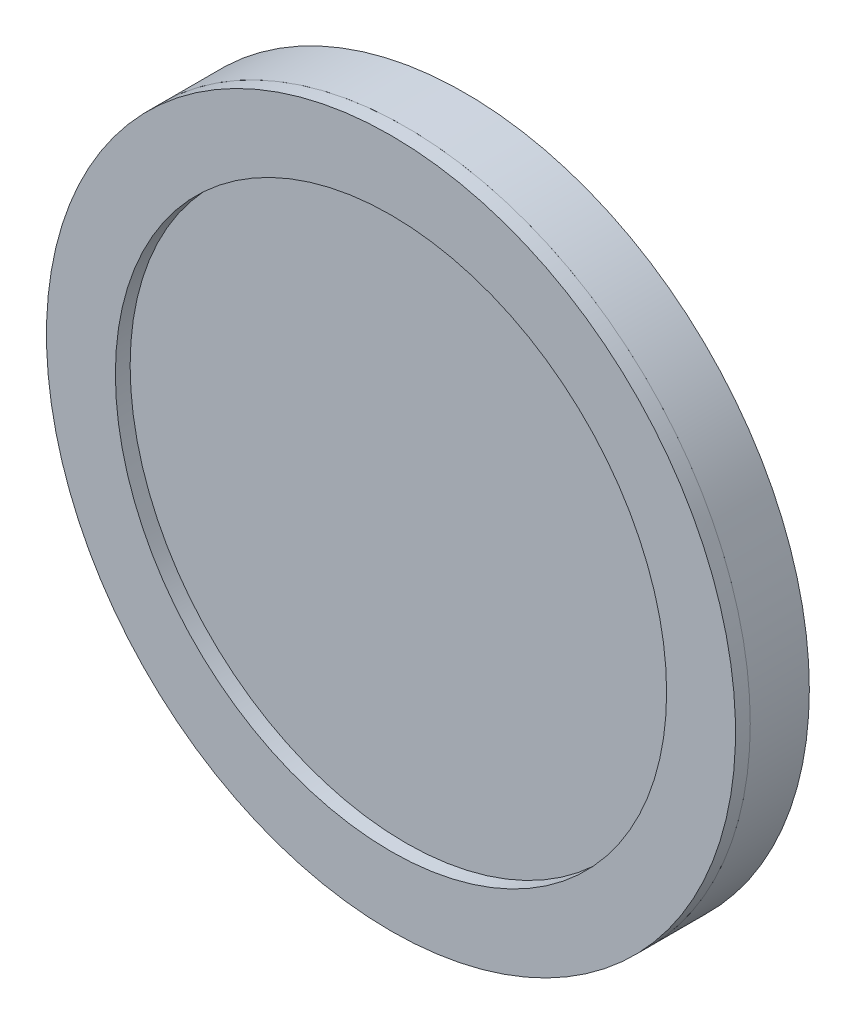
SolidWorks part; units mm, degrees
ref_plane "前视基准面" through (0, 0, 0) normal (0, 0, 1) x (1, 0, 0)
ref_plane "上视基准面" through (0, 0, 0) normal (0, 1, 0) x (1, 0, 0)
ref_plane "右视基准面" through (0, 0, 0) normal (1, 0, 0) x (0, 0, -1)
sketch "草图1" plane through (0, 0, 0) normal (0, 0, 1) x (1, 0, 0)
  circle A0 centre (-3, 52) radius 17.5
  circle A1 centre (-3, 52) radius 17.5 construction
extrude "拉伸1" add sketch "草图1" along normal blind 3
sketch "草图2" plane through (0, 0, 3) normal (0, 0, 1) x (1, 0, 0)
  circle A0 centre (-3, 52) radius 17.5
  circle A2 centre (-3, 52) radius 14
  circle A3 centre (-3, 52) radius 17.5 construction
  dimension "D1" = 28
  dimension "D2" = 35
extrude "拉伸2" add sketch "草图2" along normal up to surface (0.75 mm away)
